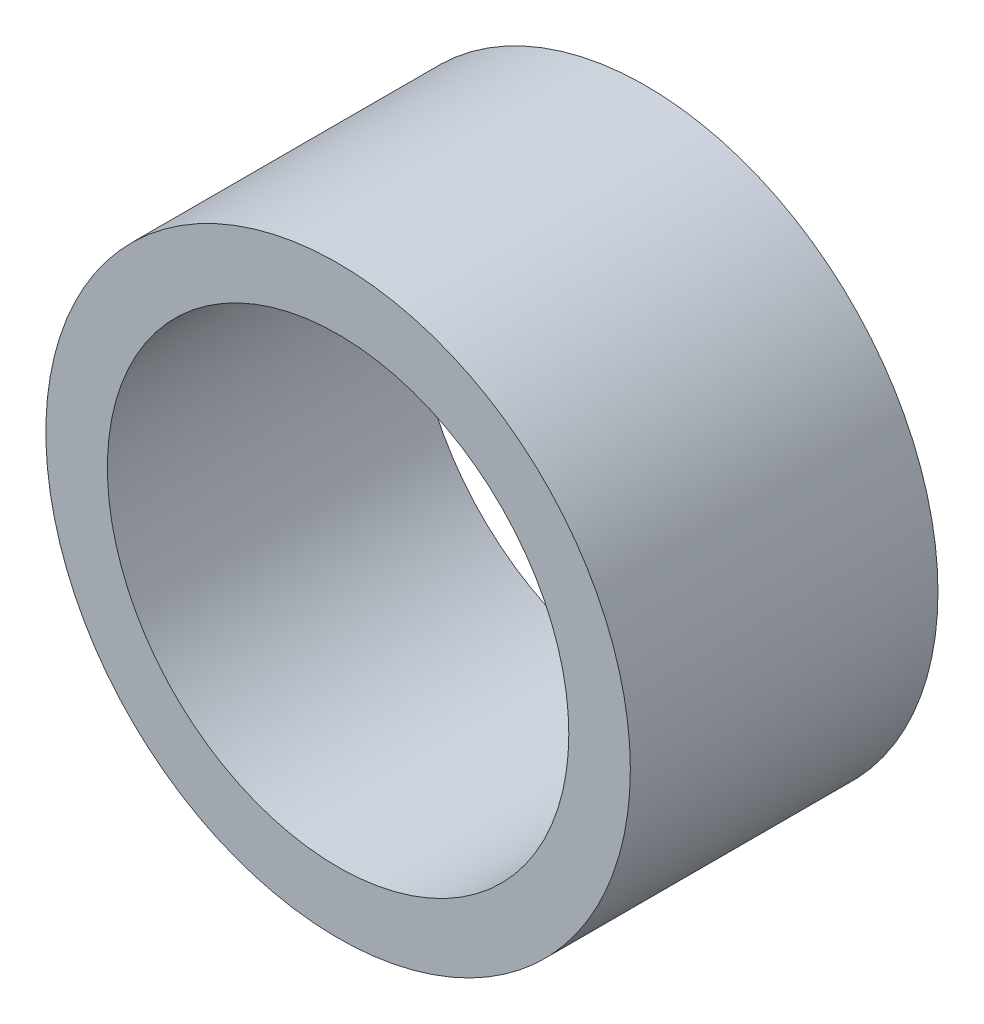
SolidWorks part; units mm, degrees
ref_plane "Plan1" through (0, 0, 0) normal (0, 0, 1) x (1, 0, 0)
ref_plane "Plan2" through (0, 0, 0) normal (0, 1, 0) x (1, 0, 0)
ref_plane "Plan3" through (0, 0, 0) normal (1, 0, 0) x (0, 0, -1)
sketch "Esquisse1" plane through (0, 0, 0) normal (0, 0, 1) x (1, 0, 0)
  circle A0 centre (0, 0) radius 19
  circle A1 centre (0, 0) radius 15
  dimension "D1" = 38
  dimension "D2" = 30
extrude "Base-Extrusion" add sketch "Esquisse1" along normal mid plane 20
